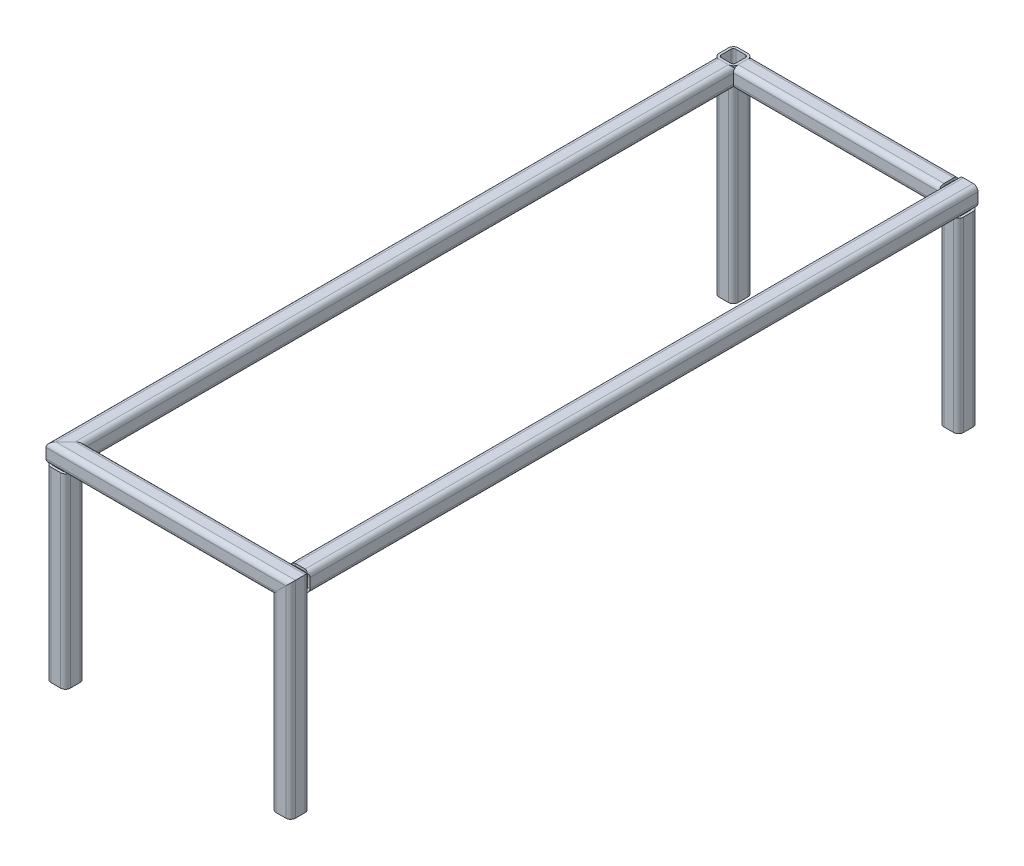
SolidWorks part; units mm, degrees
ref_plane "Front Plane" through (0, 0, 0) normal (0, 0, 1) x (1, 0, 0)
ref_plane "Top Plane" through (0, 0, 0) normal (0, 1, 0) x (1, 0, 0)
ref_plane "Right Plane" through (0, 0, 0) normal (1, 0, 0) x (0, 0, -1)
sketch3d "3DSketch1"
  line L0 (588.6395, 513.1775, 0) -> (588.6395, 513.1775, -1745.8203)
  line L1 (0, 0, 0) -> (588.6395, 0, 0)
  line L2 (0, 0, 0) -> (0, 513.1775, 0)
  line L3 (0, 513.1775, 0) -> (588.6395, 513.1775, 0)
  line L4 (588.6395, 0, 0) -> (588.6395, 513.1775, 0)
  line L5 (0, 513.1775, 0) -> (0, 513.1775, -1745.8203)
  line L6 (588.6395, 513.1775, -1745.8203) -> (0, 513.1775, -1745.8203)
  line L7 (588.6395, 513.1775, -1745.8203) -> (588.6395, 0, -1745.8203)
  line L8 (588.6395, 0, -1745.8203) -> (0, 0, -1745.8203)
  line L9 (0, 513.1775, -1745.8203) -> (0, 0, -1745.8203)
other "Structural Member1"
ref_plane "Plane3" through (0, 0, 0) normal (0, 1, 0) x (1, 0, 0)
sketch "Sketch1" plane through (0, 0, 0) normal (0, 1, 0) x (1, 0, 0)
  line L0 (-12.7, -19.05) -> (12.7, -19.05)
  line L1 (-19.05, -12.7) -> (-19.05, 12.7)
  line L2 (12.7, 19.05) -> (-12.7, 19.05)
  line L3 (19.05, 12.7) -> (19.05, -12.7)
  line L4 (-12.7, -25.4) -> (12.7, -25.4)
  line L5 (-25.4, -12.7) -> (-25.4, 12.7)
  line L6 (12.7, 25.4) -> (-12.7, 25.4)
  line L7 (25.4, 12.7) -> (25.4, -12.7)
  line L8 (0, 0) -> (19.05, 0) construction
  line L9 (0, 0) -> (0, 19.05) construction
  arc A0 (25.4, 12.7) -> (12.7, 25.4) centre (12.7, 12.7) ccw
  arc A1 (12.7, -25.4) -> (25.4, -12.7) centre (12.7, -12.7) ccw
  arc A2 (-25.4, -12.7) -> (-12.7, -25.4) centre (-12.7, -12.7) ccw
  arc A3 (-12.7, 25.4) -> (-25.4, 12.7) centre (-12.7, 12.7) ccw
  arc A4 (-12.7, 19.05) -> (-19.05, 12.7) centre (-12.7, 12.7) ccw
  arc A5 (19.05, 12.7) -> (12.7, 19.05) centre (12.7, 12.7) ccw
  arc A6 (12.7, -19.05) -> (19.05, -12.7) centre (12.7, -12.7) ccw
  arc A7 (-19.05, -12.7) -> (-12.7, -19.05) centre (-12.7, -12.7) ccw
  point P3 (0, 25.4)
  point P4 (25.4, 0)
  point P5 (0, -25.4)
  point P6 (-25.4, 0)
  point P7 (-25.4, 25.4)
  point P8 (-25.4, -25.4)
  point P33 (0, 0)
  point P35 (25.4, -25.4)
  point P36 (25.4, 25.4)
  point P37 (0, 0)
  dimension "D1" = 12.7
  dimension "Thickness" = 6.35
  dimension "V_leg" = 50.8
other "Structural Member2"
ref_plane "Plane4" through (0, 513.1775, 0) normal (0, 0, -1) x (1, 0, 0)
sketch "Sketch12" plane through (0, 513.1775, 0) normal (0, 0, -1) x (1, 0, 0)
  line L0 (-12.7, -19.05) -> (12.7, -19.05)
  line L1 (-19.05, -12.7) -> (-19.05, 12.7)
  line L2 (12.7, 19.05) -> (-12.7, 19.05)
  line L3 (19.05, 12.7) -> (19.05, -12.7)
  line L4 (-12.7, -25.4) -> (12.7, -25.4)
  line L5 (-25.4, -12.7) -> (-25.4, 12.7)
  line L6 (12.7, 25.4) -> (-12.7, 25.4)
  line L7 (25.4, 12.7) -> (25.4, -12.7)
  line L8 (0, 0) -> (19.05, 0) construction
  line L9 (0, 0) -> (0, 19.05) construction
  arc A0 (25.4, 12.7) -> (12.7, 25.4) centre (12.7, 12.7) ccw
  arc A1 (12.7, -25.4) -> (25.4, -12.7) centre (12.7, -12.7) ccw
  arc A2 (-25.4, -12.7) -> (-12.7, -25.4) centre (-12.7, -12.7) ccw
  arc A3 (-12.7, 25.4) -> (-25.4, 12.7) centre (-12.7, 12.7) ccw
  arc A4 (-12.7, 19.05) -> (-19.05, 12.7) centre (-12.7, 12.7) ccw
  arc A5 (19.05, 12.7) -> (12.7, 19.05) centre (12.7, 12.7) ccw
  arc A6 (12.7, -19.05) -> (19.05, -12.7) centre (12.7, -12.7) ccw
  arc A7 (-19.05, -12.7) -> (-12.7, -19.05) centre (-12.7, -12.7) ccw
  point P3 (0, 25.4)
  point P4 (25.4, 0)
  point P5 (0, -25.4)
  point P6 (-25.4, 0)
  point P7 (-25.4, 25.4)
  point P8 (-25.4, -25.4)
  point P33 (0, 0)
  point P35 (25.4, -25.4)
  point P36 (25.4, 25.4)
  point P37 (0, 0)
  dimension "D1" = 12.7
  dimension "Thickness" = 6.35
  dimension "V_leg" = 50.8
other "Trim/Extend1"
other "Trim/Extend4"
other "Trim/Extend5"
other "Trim/Extend6"
other "Trim/Extend7"
other "Trim/Extend8"
other "Trim/Extend9"
